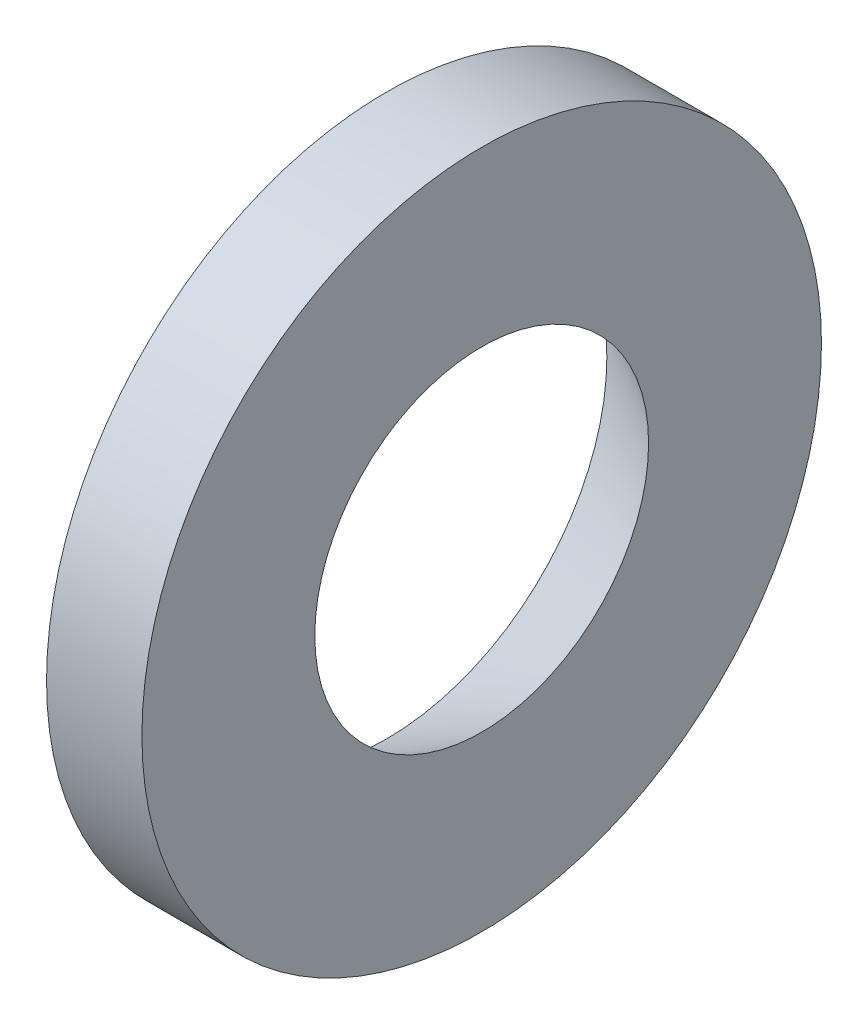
SolidWorks part; units mm, degrees
ref_plane "Front Plane" through (0, 0, 0) normal (0, 0, 1) x (1, 0, 0)
ref_plane "Top Plane" through (0, 0, 0) normal (0, 1, 0) x (1, 0, 0)
ref_plane "Right Plane" through (0, 0, 0) normal (1, 0, 0) x (0, 0, -1)
sketch "Sketch2" plane through (0, 0, 0) normal (0, 0, 1) x (1, 0, 0)
  line L0 (0, 46.25) -> (0, 71.25)
  line L1 (0, 71.25) -> (20, 71.25)
  line L2 (20, 71.25) -> (20, 35)
  line L3 (20, 35) -> (0, 46.25)
  line L4 (0, 0) -> (88.2143, 0) construction
  dimension "D1" = 71.25
  dimension "D2" = 20
  dimension "D3" = 35
  dimension "D4" = 25
revolve "Revolve1" add sketch "Sketch2" angle 360 about L4
